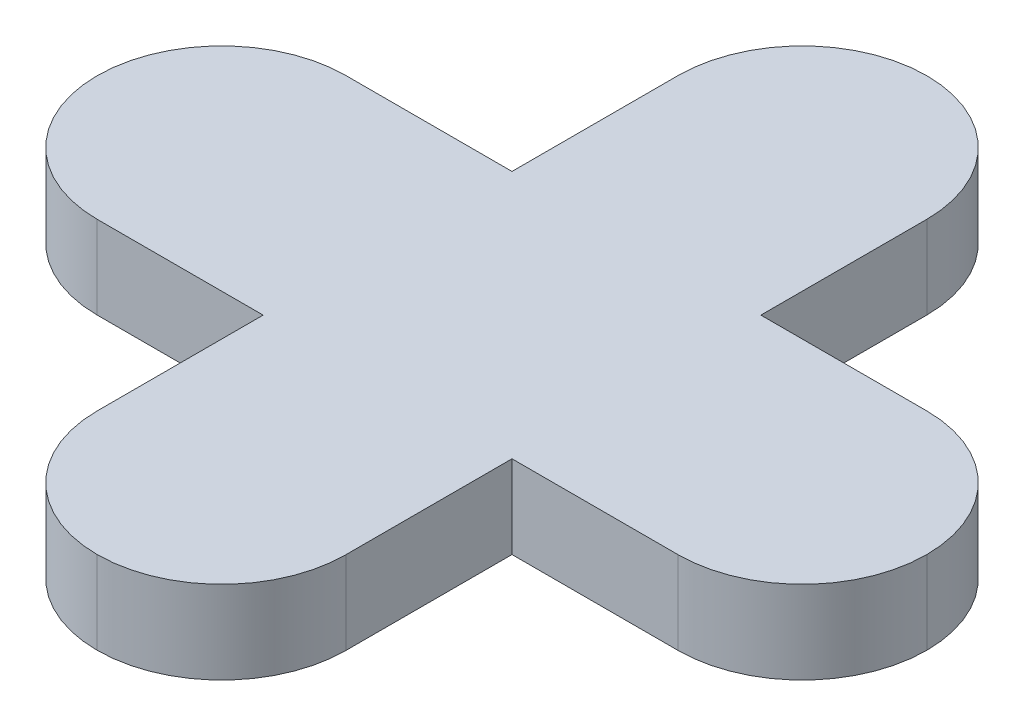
SolidWorks part; units mm, degrees
ref_plane "Plan de face" through (0, 0, 0) normal (0, 0, 1) x (1, 0, 0)
ref_plane "Plan de dessus" through (0, 0, 0) normal (0, 1, 0) x (1, 0, 0)
ref_plane "Plan de droite" through (0, 0, 0) normal (1, 0, 0) x (0, 0, -1)
sketch "Esquisse1" plane through (0, 0, 0) normal (0, 1, 0) x (1, 0, 0)
  line L0 (24.5657, 0) -> (-24.5231, 0) construction
  line L1 (0, 20.8143) -> (0, -25.4725) construction
  line L2 (-10, -3) -> (-10, 3)
  line L3 (-10, 3) -> (-3, 3)
  line L4 (-3, 3) -> (-3, 10)
  line L5 (-3, 10) -> (3, 10)
  line L6 (10, -3) -> (10, 3)
  line L7 (10, 3) -> (3, 3)
  line L8 (3, 3) -> (3, 10)
  line L9 (10, -3) -> (3, -3)
  line L10 (3, -3) -> (3, -10)
  line L11 (-3, -10) -> (3, -10)
  line L12 (-3, -3) -> (-3, -10)
  line L13 (-10, -3) -> (-3, -3)
  point P15 (0, 10)
  point P16 (10, 0)
  point P21 (-10, 0)
  dimension "D1" = 10
  dimension "D2" = 10
  dimension "D3" = 3
  dimension "D4" = 3
extrude "Boss.-Extru.1" add sketch "Esquisse1" along normal blind 2
fillet "Congé1" radius 3 8 edges at (-3, 1, -10) (3, 1, -10) (-10, 1, -3) (-10, 1, 3) (-3, 1, 10) (3, 1, 10) (10, 1, -3) (10, 1, 3)
